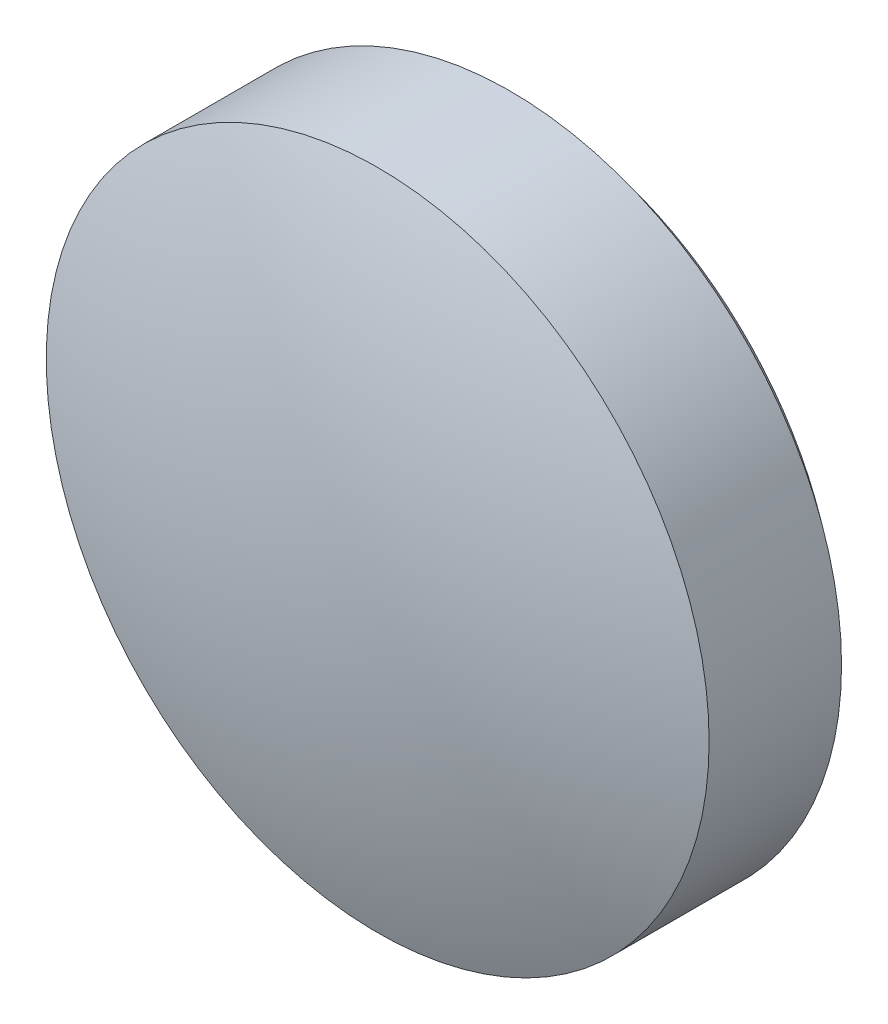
SolidWorks part; units mm, degrees
ref_plane "Front Plane" through (0, 0, 0) normal (0, 0, 1) x (1, 0, 0)
ref_plane "Top Plane" through (0, 0, 0) normal (0, 1, 0) x (1, 0, 0)
ref_plane "Right Plane" through (0, 0, 0) normal (1, 0, 0) x (0, 0, -1)
sketch "Sketch1" plane through (0, 0, 0) normal (0, 0, 1) x (1, 0, 0)
  circle A0 centre (0, 0) radius 17
  dimension "D1" = 34
extrude "Boss-Extrude1" add sketch "Sketch1" along normal blind 6.7923
sketch "Sketch2" plane through (0, 0, 0) normal (0, 1, 0) x (1, 0, 0)
  line L0 (17, 0) -> (0, 0)
  line L1 (0, 0) -> (0, 6.1177)
  arc A0 (-17, 0) -> (17, 0) centre (0, -20.5613) cw construction
  arc A1 (0, 6.1177) -> (17, 0) centre (0, -20.5613) cw
  dimension "D1" = 26.679
revolve "Revolve1" add sketch "Sketch2" angle 360 about L1
sketch "Sketch3" plane through (0, 0, 0) normal (0, 1, 0) x (1, 0, 0)
  line L0 (-17, -6.7923) -> (17, -6.7923) construction
  line L1 (17, -6.7923) -> (0, -6.7923)
  line L2 (0, -6.7923) -> (0, -9.8854)
  arc A0 (-17, -6.7923) -> (17, -6.7923) centre (0, 38.3786) ccw construction
  arc A1 (0, -9.8854) -> (17, -6.7923) centre (0, 38.3786) ccw
  dimension "D1" = 48.264
revolve "Revolve2" add sketch "Sketch3" angle 360 about L2
ref_plane "Plane1" through (0, 0, -6.1177) normal (0, 0, -1) x (-1, 0, 0)
ref_plane "Plane2" through (0, 0, 9.8854) normal (0, 0, 1) x (1, 0, 0)
